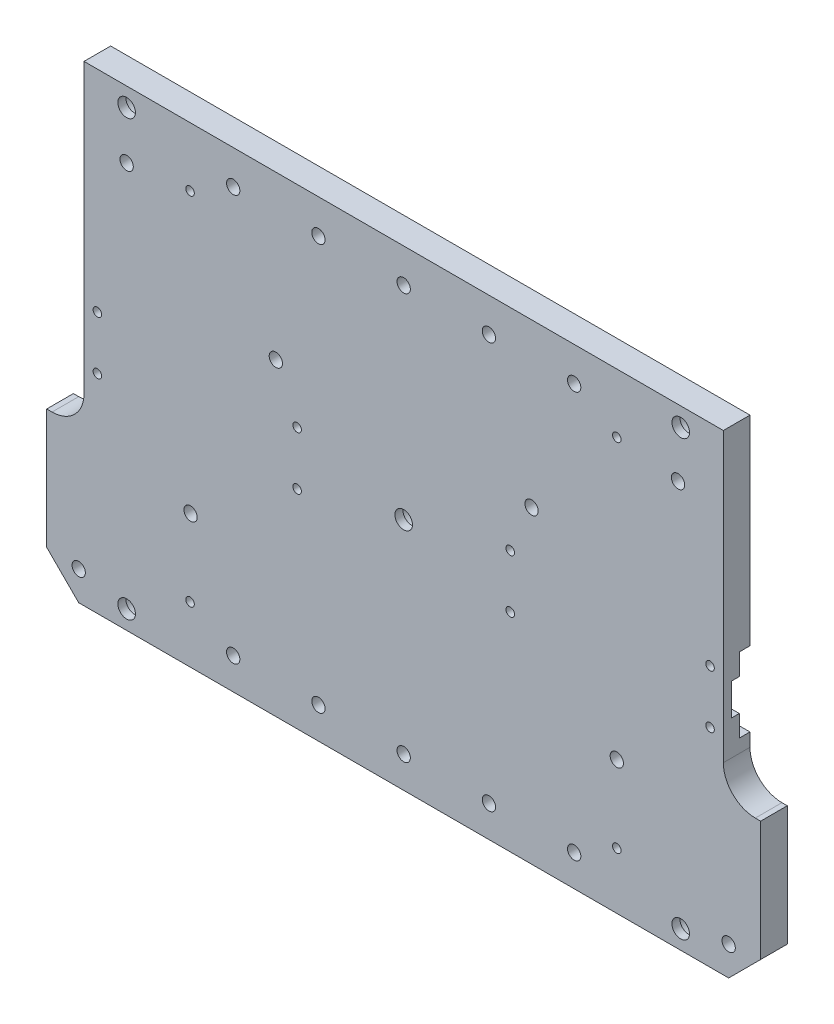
SolidWorks part; units mm, degrees
ref_plane "Спереди" through (0, 0, 0) normal (0, 0, 1) x (1, 0, 0)
ref_plane "Сверху" through (0, 0, 0) normal (0, 1, 0) x (1, 0, 0)
ref_plane "Справа" through (0, 0, 0) normal (1, 0, 0) x (0, 0, -1)
sketch "Эскиз1" plane through (0, 0, 0) normal (0, 0, 1) x (1, 0, 0)
  line L1 (0, 0) -> (134, 0)
  line L2 (0, 0) -> (0, 88.5)
  line L3 (0, 88.5) -> (134, 88.5)
  line L4 (134, 0) -> (134, 88.5)
  dimension "D1" = 134
  dimension "D2" = 88.5
extrude "Бобышка-Вытянуть1" add sketch "Эскиз1" along normal blind 5
sketch "Эскиз2" plane through (0, 0, 5) normal (0, 0, 1) x (1, 0, 0)
  line L0 (35, 82.1) -> (99, 82.1) construction
  line L1 (99, 82.1) -> (99, 5.9) construction
  line L2 (134, 44.25) -> (0, 44.25) construction
  line L3 (134, 0) -> (134, 88.5) construction
  line L4 (0, 88.5) -> (0, 0) construction
  line L6 (83, 82.1) -> (83, 5.9) construction
  line L7 (67, 82.1) -> (67, 5.9) construction
  line L8 (51, 82.1) -> (51, 5.9) construction
  line L9 (35, 82.1) -> (35, 5.9) construction
  line L10 (99, 5.9) -> (35, 5.9) construction
  line L11 (67, 44.25) -> (67, 110.6141) construction
  line L12 (0, 0) -> (134, 0) construction
  circle A0 centre (35, 82.1) radius 0.5
  dimension "D1" = 1
  dimension "D2" = 5.9
  dimension "D3" = 82.1
  dimension "D4" = 16
  dimension "D5" = 16
  dimension "D6" = 16
  dimension "D7" = 16
hole_wizard "Отверстие обработанное метчиком M31" positions "Трехмерный эскиз1" profile "Эскиз3" tap size "M3" standard "ГОСТ"
sketch3d "Трехмерный эскиз1"
  line L0 (99, 5.9, 5) -> (35, 5.9, 5) construction
  point P0 (35, 82.1, 5)
  point P3 (51, 82.1, 5)
  point P6 (67, 82.1, 5)
  point P9 (83, 82.1, 5)
  point P12 (99, 82.1, 5)
  point P15 (35, 5.9, 5)
  point P18 (51, 5.9, 5)
  point P21 (67, 5.9, 5)
  point P25 (83, 5.9, 5)
  point P28 (99, 5.9, 5)
sketch "Эскиз3" plane through (35, 82.1, 5) normal (1, 0, 0) x (0, -1, 0)
  line L0 (0, 0) -> (0, 9.2511)
  line L1 (0, 9.2511) -> (1.25, 8.5)
  line L2 (1.25, 8.5) -> (1.25, 0)
  line L5 (1.25, 0) -> (0, 0)
  line L10 (0, 9.2511) -> (-1.25, 8.5) construction
  line L11 (0, -6.35) -> (0, 107.95) construction
  dimension "Диаметр сверла" = 2.5
  dimension "Глубина сверла" = 8.5
  dimension "Угол заточки сверла" = 118
sketch "Эскиз4" plane through (0, 0, 5) normal (0, 0, 1) x (1, 0, 0)
  line L0 (0, 88.5) -> (0, 0) construction
  line L1 (134, 88.5) -> (0, 88.5) construction
  line L2 (134, 0) -> (134, 88.5) construction
  line L3 (15, 85) -> (119, 85) construction
  line L4 (119, 85) -> (119, 3.5) construction
  line L5 (119, 3.5) -> (15, 3.5) construction
  line L6 (15, 3.5) -> (15, 85) construction
  line L7 (0, 0) -> (134, 0) construction
  line L8 (134, 44.25) -> (0, 44.25) construction
  circle A0 centre (15, 85) radius 3 construction
  circle A1 centre (15, 85) radius 1
  circle A2 centre (119, 85) radius 1
  circle A3 centre (67, 44.25) radius 3 construction
  dimension "D1" = 6
  dimension "D2" = 15
  dimension "D3" = 3.5
  dimension "D4" = 2
  dimension "D5" = 15
  dimension "D6" = 2
  dimension "D8" = 6
  dimension "D7" = 3.5
hole_wizard "Отверстие обработанное метчиком M41" positions "Трехмерный эскиз2" profile "Эскиз5" tap size "M4" standard "ISO"
sketch3d "Трехмерный эскиз2"
  line L0 (67, 82.1, 5) -> (67, 5.9, 5) construction
  line L4 (0, 0, 5) -> (134, 0, 5) construction
  point P0 (15, 85, 5)
  point P3 (119, 85, 5)
  point P6 (67, 44, 5)
  point P9 (15, 3.5, 5)
  point P12 (119, 3.5, 5)
  dimension "D1" = 44
sketch "Эскиз5" plane through (15, 85, 5) normal (1, 0, 0) x (0, -1, 0)
  line L0 (0, 0) -> (0, 5)
  line L1 (0, 5) -> (1.65, 5)
  line L2 (1.65, 5) -> (1.65, 0)
  line L5 (1.65, 0) -> (0, 0)
  line L11 (0, -6.35) -> (0, 107.95) construction
  dimension "Диаметр проходного сверла" = 3.3
  dimension "Глубина проходного сверла" = 5
hole_wizard "Отверстие обработанное метчиком M21" positions "Трехмерный эскиз3" profile "Эскиз6" tap size "M2" standard "ГОСТ"
sketch3d "Трехмерный эскиз3"
  line L0 (107, 77.4, 5) -> (26.9, 77.4, 5) construction
  line L4 (107, 77.4, 5) -> (107, 10.6, 5) construction
  line L6 (107, 10.6, 5) -> (26.9, 10.6, 5) construction
  line L9 (26.9, 10.6, 5) -> (26.9, 77.4, 5) construction
  line L16 (134, 0, 5) -> (134, 88.5, 5) construction
  circle A0 centre (99, 5.9, 5) radius 1.25 construction
  circle A1 centre (35, 82.1, 5) radius 1.25 construction
  point P0 (107, 77.4, 5)
  point P2 (26.9, 77.4, 5)
  point P4 (26.9, 10.6, 5)
  point P6 (107, 10.6, 5)
  point P49 (99, 5.9, 6.25)
  point P52 (35, 82.1, 6.25)
  dimension "D1" = 4.7
  dimension "D2" = 27
  dimension "D3" = 80.1
  dimension "D4" = 4.7
sketch "Эскиз6" plane through (107, 77.4, 5) normal (1, 0, 0) x (0, -1, 0)
  line L0 (0, 0) -> (0, 5)
  line L1 (0, 5) -> (0.8, 5)
  line L2 (0.8, 5) -> (0.8, 0)
  line L5 (0.8, 0) -> (0, 0)
  line L11 (0, -6.35) -> (0, 107.95) construction
  dimension "Диаметр проходного сверла" = 1.6
  dimension "Глубина проходного сверла" = 5
chamfer "Фаска1" distance 6 angle 45 4 edges at (0, 88.5, 2.5) (0, 0, 2.5) (134, 0, 2.5) (134, 88.5, 2.5)
sketch "Эскиз7" plane through (0, 0, 0) normal (0, 0, -1) x (-1, 0, 0)
  line L0 (-67, 44) -> (-67, 61.6402) construction
  line L1 (-67, 82.1) -> (-67, 5.9) construction
  line L2 (2, 47) -> (2, 41)
  line L3 (-39, 47) -> (2, 47)
  line L4 (-43, 45.5) -> (-40.5, 45.5)
  line L5 (-93.5, 45.5) -> (-93.5, 42.5) construction
  line L6 (-136, 41) -> (-95, 41)
  line L7 (-93.5, 42.5) -> (-91, 42.5)
  line L9 (-91, 45.5) -> (-93.5, 45.5)
  line L10 (-95, 47) -> (-136, 47)
  line L11 (-136, 47) -> (-136, 41)
  line L12 (-134, 44) -> (-21.5657, 44) construction
  line L13 (-91, 44) -> (-91, 58.4779) construction
  line L14 (-40.5, 42.5) -> (-43, 42.5)
  line L16 (2, 41) -> (-39, 41)
  line L18 (-134, 6) -> (-134, 82.5) construction
  arc A0 (-40.5, 45.5) -> (-39, 47) centre (-39, 45.5) cw
  arc A1 (-43, 42.5) -> (-43, 45.5) centre (-43, 44) cw
  arc A2 (-39, 41) -> (-40.5, 42.5) centre (-39, 42.5) cw
  arc A4 (-95, 41) -> (-93.5, 42.5) centre (-95, 42.5) ccw
  arc A5 (-91, 42.5) -> (-91, 45.5) centre (-91, 44) ccw
  arc A7 (-93.5, 45.5) -> (-95, 47) centre (-95, 45.5) ccw
  dimension "D2" = 2
  dimension "D5" = 1.5
  dimension "D7" = 1.5
  dimension "D10" = 4
  dimension "D11" = 1.5
  dimension "D12" = 1.5
  dimension "D13" = 1.5
  dimension "D3" = 1.5
  dimension "D4" = 1.5
  dimension "D6" = 24
  dimension "D8" = 6
  dimension "D9" = 3
extrude "Вырез-Вытянуть2" cut sketch "Эскиз7" against normal blind 3.5
sketch "Эскиз8" plane through (0, 0, 0) normal (0, 0, -1) x (-1, 0, 0)
  line L0 (0, 82.5) -> (0, 47) construction
  line L1 (-7, 88.5) -> (13, 88.5)
  line L2 (-7, 88.5) -> (-7, 28.5)
  line L3 (-7, 28.5) -> (13, 28.5)
  line L4 (13, 88.5) -> (13, 28.5)
  line L5 (-128, 88.5) -> (-6, 88.5) construction
  line L6 (-67, 44) -> (-67, 133.3968) construction
  line L7 (-67, 82.1) -> (-67, 5.9) construction
  line L8 (-147, 88.5) -> (-147, 28.5)
  line L9 (-127, 28.5) -> (-147, 28.5)
  line L10 (-127, 88.5) -> (-127, 28.5)
  line L11 (-127, 88.5) -> (-147, 88.5)
  dimension "D1" = 7
  dimension "D2" = 60
  dimension "D3" = 20
  dimension "D4" = 60
extrude "Вырез-Вытянуть3" cut sketch "Эскиз8" against normal through all
fillet "Скругление1" radius 6 2 edges at (127, 28.5, 2.5) (7, 28.5, 2.5)
sketch "Эскиз9" plane through (0, 0, 0) normal (0, 0, -1) x (-1, 0, 0)
  line L0 (-91, 58) -> (-43, 58) construction
  line L1 (-43, 58) -> (-43, 25) construction
  line L2 (-91, 58) -> (-91, 25) construction
  line L3 (-107, 25) -> (-27, 25) construction
  line L4 (-43, 58) -> (-15, 58) construction
  line L5 (-15, 3.5) -> (-15, 85) construction
  line L6 (-15, 58) -> (-15, 76) construction
  line L7 (-91, 58) -> (-119, 58) construction
  line L8 (-119, 85) -> (-119, 3.5) construction
  line L9 (-127, 34.5) -> (-127, 88.5) construction
  line L10 (-127, 88.5) -> (-7, 88.5) construction
  line L11 (-118.5, 76) -> (-118.5, 58) construction
  line L12 (-134, 6) -> (-134, 28.5) construction
  line L13 (-6, 0) -> (-128, 0) construction
  line L14 (0, 28.5) -> (0, 6) construction
  point P0 (-118.5, 76)
  point P1 (-91, 58)
  point P3 (-43, 58)
  point P5 (-15, 76)
  point P7 (-27, 25)
  point P9 (-6, 5.5)
  point P11 (-107, 25)
  point P13 (-128, 5.5)
  dimension "D1" = 48
  dimension "D2" = 33
  dimension "D3" = 30.5
  dimension "D4" = 18
  dimension "D5" = 12.5
  dimension "D6" = 36
  dimension "D7" = 8.5
  dimension "D8" = 16
  dimension "D9" = 16
  dimension "D10" = 6
  dimension "D11" = 5.5
  dimension "D12" = 5.5
  dimension "D13" = 6
hole_wizard "Отверстие обработанное метчиком M32" positions "Трехмерный эскиз4" profile "Эскиз10" tap size "M3" standard "ГОСТ"
sketch3d "Трехмерный эскиз4"
  point P0 (118.5, 76, 0)
  point P2 (91, 58, 0)
  point P6 (43, 58, 0)
  point P8 (27, 25, 0)
  point P10 (6, 5.5, 0)
  point P12 (128, 5.5, 0)
  point P14 (107, 25, 0)
  point P16 (15, 76, 0)
sketch "Эскиз10" plane through (118.5, 76, 0) normal (1, 0, 0) x (0, 1, 0)
  line L0 (0, 0) -> (0, 5)
  line L1 (0, 5) -> (1.25, 5)
  line L2 (1.25, 5) -> (1.25, 0)
  line L5 (1.25, 0) -> (0, 0)
  line L11 (0, -6.35) -> (0, 107.95) construction
  dimension "Диаметр проходного сверла" = 2.5
  dimension "Глубина проходного сверла" = 5
sketch "Эскиз11" plane through (0, 0, 0) normal (0, 0, -1) x (-1, 0, 0)
  line L0 (-7, 88.5) -> (-7, 47) construction
  line L1 (-49.5, 51) -> (-7, 51)
  line L2 (-49.5, 51) -> (-49.5, 37)
  line L3 (-49.5, 37) -> (-7, 37)
  line L4 (-7, 51) -> (-7, 37)
  line L6 (-44.5, 44) -> (3.2337, 44) construction
  arc A0 (-43, 45.5) -> (-43, 42.5) centre (-43, 44) ccw construction
  point P9 (-44.5, 44)
  dimension "D1" = 5
  dimension "D2" = 7
  dimension "D3" = 14
extrude "Вырез-Вытянуть4" cut sketch "Эскиз11" against normal blind 1
sketch "Эскиз12" plane through (0, 0, 5) normal (0, 0, 1) x (1, 0, 0)
  circle A0 centre (67, 44) radius 5
  dimension "D1" = 10
extrude "Вырез-Вытянуть5" [suppressed] cut sketch "Эскиз12" against normal blind 1.5
sketch "Эскиз13" plane through (0, 0, 0) normal (0, 0, -1) x (-1, 0, 0)
  line L0 (-49.5, 37) -> (-7, 37) construction
  line L1 (-49.5, 51) -> (-44.5, 51)
  line L2 (-49.5, 51) -> (-49.5, 47) construction
  line L3 (-49.5, 47) -> (-44.5, 47)
  line L4 (-44.5, 51) -> (-44.5, 47) construction
  line L5 (-14, 39) -> (-12, 39) construction
  line L7 (-44.5, 37) -> (-44.5, 41) construction
  line L8 (-49.5, 37) -> (-49.5, 41) construction
  line L9 (-49.5, 41) -> (-44.5, 41)
  line L10 (-49.5, 37) -> (-44.5, 37)
  line L11 (-12, 51) -> (-7, 51)
  line L12 (-12, 37) -> (-12, 40.75) construction
  line L13 (-7, 51) -> (-7, 46.5)
  line L14 (-12, 51) -> (-12, 47.25) construction
  line L15 (-7, 51) -> (-49.5, 51) construction
  line L16 (-7, 41) -> (-7, 47) construction
  line L17 (-14, 49) -> (-14, 46.5)
  line L18 (-14, 46.5) -> (-7, 46.5)
  line L19 (-14, 42) -> (-7, 42)
  line L20 (-14, 39) -> (-14, 42)
  line L21 (-7, 37) -> (-7, 42)
  line L22 (-12, 37) -> (-7, 37)
  line L23 (-49.5, 51) -> (-49.5, 37) construction
  arc A0 (-44.5, 51) -> (-44.5, 47) centre (-44.5, 49) cw
  arc A1 (-49.5, 51) -> (-49.5, 47) centre (-49.5, 49) ccw
  arc A2 (-49.5, 37) -> (-49.5, 41) centre (-49.5, 39) cw
  arc A3 (-44.5, 37) -> (-44.5, 41) centre (-44.5, 39) ccw
  arc A4 (-12, 51) -> (-14, 49) centre (-12, 49) ccw
  arc A5 (-12, 37) -> (-14, 39) centre (-12, 39) cw
  dimension "D3" = 2
  dimension "D9" = 2
  dimension "D10" = 2
  dimension "D11" = 2
  dimension "D1" = 5
  dimension "D2" = 4
  dimension "D4" = 5
  dimension "D5" = 4
  dimension "D6" = 4.5
  dimension "D7" = 5
  dimension "D8" = 4
  dimension "D12" = 5
  dimension "D13" = 4
  dimension "D14" = 5
extrude "Вырез-Вытянуть6" cut sketch "Эскиз13" against normal blind 2
ref_plane "Плоскость1" through (67, 0, 0) normal (-1, 0, 0) x (0, 0, 1)
mirror "Зеркальное отражение1" about plane through (67, 0, 0) normal (-1, 0, 0) of "Вырез-Вытянуть6", "Вырез-Вытянуть4"
hole_wizard "Отверстие обработанное метчиком M22" positions "Трехмерный эскиз5" profile "Эскиз14" tap size "M2" standard "ISO"
sketch3d "Трехмерный эскиз5"
  line L0 (47, 49, 2) -> (47, 39, 2) construction
  line L1 (47, 39, 2) -> (9.5, 39, 2) construction
  line L3 (47, 49, 2) -> (9.5, 49, 2) construction
  line L6 (9.5, 49, 2) -> (9.5, 39, 2) construction
  line L9 (7, 47, 2) -> (7, 51, 2) construction
  point P0 (47, 49, 2)
  point P2 (47, 39, 2)
  point P4 (9.5, 39, 2)
  point P6 (9.5, 49, 2)
  dimension "D1" = 2
  dimension "D2" = 2
  dimension "D3" = 2.5
  dimension "D4" = 2.5
sketch "Эскиз14" plane through (47, 49, 2) normal (1, 0, 0) x (0, 1, 0)
  line L0 (0, 0) -> (0, 3)
  line L1 (0, 3) -> (0.8, 3)
  line L2 (0.8, 3) -> (0.8, 0)
  line L5 (0.8, 0) -> (0, 0)
  line L11 (0, -6.35) -> (0, 107.95) construction
  dimension "Диаметр проходного сверла" = 1.6
  dimension "Глубина проходного сверла" = 3
mirror "Зеркальное отражение2" about plane through (67, 0, 0) normal (-1, 0, 0) of "Отверстие обработанное метчиком M22"
sketch "Эскиз15" plane through (0, 0, 5) normal (0, 0, 1) x (1, 0, 0)
  line L10 (134, 28.5) -> (133, 28.5)
  line L11 (127, 34.5) -> (127, 88.5)
  line L12 (127, 88.5) -> (7, 88.5)
  line L13 (7, 88.5) -> (7, 34.5)
  line L14 (1, 28.5) -> (0, 28.5)
  line L15 (0, 28.5) -> (0, 6)
  line L16 (0, 6) -> (6, 0)
  line L17 (6, 0) -> (128, 0)
  line L18 (128, 0) -> (134, 6)
  line L19 (134, 6) -> (134, 28.5)
  line L20 (134, 28.5) -> (133, 28.5)
  line L21 (127, 34.5) -> (127, 88.5)
  line L22 (127, 88.5) -> (7, 88.5)
  line L23 (7, 88.5) -> (7, 34.5)
  line L24 (1, 28.5) -> (0, 28.5)
  line L25 (0, 28.5) -> (0, 6)
  line L26 (0, 6) -> (6, 0)
  line L27 (6, 0) -> (128, 0)
  line L28 (128, 0) -> (134, 6)
  line L29 (134, 6) -> (134, 28.5)
  arc A2 (127, 34.5) -> (133, 28.5) centre (133, 34.5) ccw
  arc A3 (1, 28.5) -> (7, 34.5) centre (1, 34.5) ccw
  arc A4 (127, 34.5) -> (133, 28.5) centre (133, 34.5) ccw
  arc A5 (1, 28.5) -> (7, 34.5) centre (1, 34.5) ccw
  dimension "D1" = 0
sketch "Эскиз16" plane through (0, 0, 0) normal (0, 0, -1) x (-1, 0, 0)
  circle A0 centre (-15, 85) radius 2.5
  circle A1 centre (-119, 85) radius 2.5
  circle A2 centre (-119, 3.5) radius 2.5
  circle A3 centre (-15, 3.5) radius 2.5
  circle A4 centre (-67, 44) radius 2.5
  circle A5 centre (-67, 44) radius 1.65 construction
  dimension "D1" = 5
  dimension "D2" = 5
  dimension "D3" = 5
  dimension "D4" = 5
  dimension "D5" = 5
extrude "Вырез-Вытянуть7" cut sketch "Эскиз16" against normal blind 3.5
sketch3d "Трехмерный эскиз6"
  line L0 (67, 44.25, 5) -> (67, 44.25, 3.5) construction
  line L1 (67, 44.25, 3.5) -> (7, 44.25, 3.5) construction
  line L2 (67, 44.25, 3.5) -> (127, 44.25, 3.5) construction
